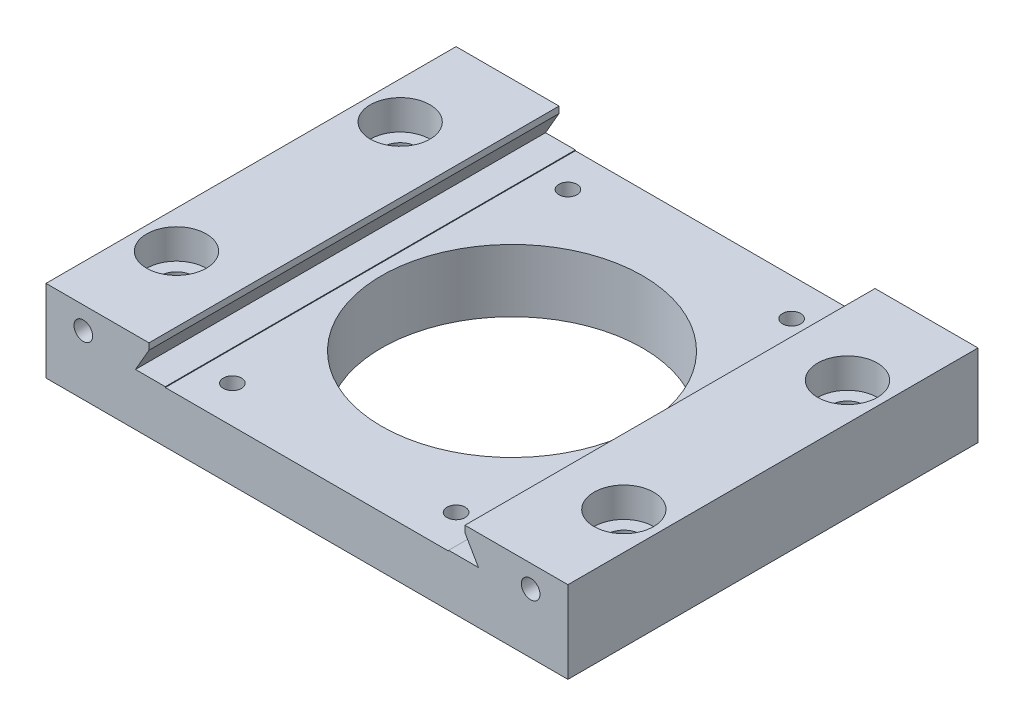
SolidWorks part; units mm, degrees
ref_plane "Front Plane" through (0, 0, 0) normal (0, 0, 1) x (1, 0, 0)
ref_plane "Top Plane" through (0, 0, 0) normal (0, 1, 0) x (1, 0, 0)
ref_plane "Right Plane" through (0, 0, 0) normal (1, 0, 0) x (0, 0, -1)
sketch "Sketch1" plane through (0, 0, 0) normal (1, 0, 0) x (0, 0, -1)
  line L0 (0, 0) -> (27.5, 0)
  line L1 (27.5, 0) -> (27.5, 11)
  line L2 (27.5, 11) -> (-27.5, 11)
  line L3 (-27.5, 11) -> (-27.5, 0)
  line L4 (-27.5, 0) -> (0, 0)
  dimension "D1" = 27.5
  dimension "D2" = 27.5
  dimension "D3" = 11
extrude "Boss-Extrude1" add sketch "Sketch1" along normal mid plane 70
sketch "Sketch2" plane through (0, 0, 27.5) normal (0, 0, 1) x (1, 0, 0)
  line L0 (-20.6906, 11) -> (-23, 7)
  line L2 (35, 11) -> (-35, 11) construction
  line L3 (-23, 7) -> (0, 7)
  line L5 (23, 7) -> (20.6906, 11)
  line L6 (20.6906, 11) -> (-20.6906, 11)
  line L8 (0, 7) -> (23, 7)
  line L9 (0, 0) -> (0, 7) construction
  dimension "D1" = 23
  dimension "D2" = 60
  dimension "D3" = 60
  dimension "D4" = 4
extrude "Cut-Extrude1" cut sketch "Sketch2" against normal through all
sketch "Sketch4" plane through (0, 7, 0) normal (0, 1, 0) x (1, 0, 0)
  line L0 (-23, 27.5) -> (23, 27.5) construction
  line L1 (-19, -27.5) -> (19, -27.5)
  line L2 (-19, -27.5) -> (-19, 27.5)
  line L3 (-19, 27.5) -> (19, 27.5)
  line L4 (19, -27.5) -> (19, 27.5)
  line L5 (-19, -27.5) -> (19, 27.5) construction
  line L6 (-19, 27.5) -> (19, -27.5) construction
  point P0 (0, 0)
  dimension "D1" = 38
extrude "Cut-Extrude3" cut sketch "Sketch4" against normal blind 0.1
sketch "Sketch5" plane through (0, 11, 0) normal (0, 1, 0) x (1, 0, 0)
  line L0 (-20.6906, 27.5) -> (-20.6906, -27.5) construction
  line L1 (-20.6906, -8) -> (-24, -8)
  line L2 (-20.6906, -8) -> (-20.6906, 8)
  line L3 (-20.6906, 8) -> (-24, 8)
  line L4 (-24, -8) -> (-24, 8)
  line L5 (20.6906, 27.5) -> (20.6906, -27.5) construction
  line L6 (20.6906, -8) -> (24, -8)
  line L7 (20.6906, -8) -> (20.6906, 8)
  line L8 (20.6906, 8) -> (24, 8)
  line L9 (24, -8) -> (24, 8)
  line L10 (35, -27.5) -> (20.6906, -27.5) construction
  dimension "D1" = 24
  dimension "D2" = 16
  dimension "D3" = 19.5
extrude "Cut-Extrude4" [suppressed] cut sketch "Sketch5" against normal up to surface (4 mm away)
sketch "Sketch11" plane through (0, 0, 0) normal (0, -1, 0) x (1, 0, 0)
  line L1 (-13, 22.5) -> (-26, 22.5) construction
  line L2 (-13, 19.5) -> (-26, 19.5)
  line L3 (-13, 25.5) -> (-26, 25.5)
  arc A0 (-13, 19.5) -> (-13, 25.5) centre (-13, 22.5) ccw
  arc A1 (-26, 25.5) -> (-26, 19.5) centre (-26, 22.5) ccw
  point P6 (-19.5, 22.5)
  dimension "D1" = 3
  dimension "D2" = 22.5
  dimension "D3" = 13
  dimension "D4" = 19.5
extrude "Cut-Extrude7" cut sketch "Sketch11" against normal blind 4.5
hole_wizard "M3x0.5 Tapped Hole1" positions "Sketch23" profile "Sketch22" tap size "M3x0.5" standard "ANSI Metric"
sketch "Sketch23" plane through (0, 4.5, 0) normal (0, -1, 0) x (-1, 0, 0)
  line L1 (25.5, -25.5) -> (25.5, -22.5) construction
  line L2 (13, -25.5) -> (26, -25.5) construction
  line L3 (25.5, -22.5) -> (25.5, -19.5) construction
  line L4 (26, -19.5) -> (13, -19.5) construction
  point P0 (25.5, -22.5)
  dimension "D1" = 25.5
sketch "Sketch22" plane through (-25.5, 4.5, 22.5) normal (1, 0, 0) x (0, 0, -1)
  line L0 (0, 0) -> (0, 5.2511)
  line L1 (0, 5.2511) -> (1.25, 4.5)
  line L2 (1.25, 4.5) -> (1.25, 0)
  line L5 (1.25, 0) -> (0, 0)
  line L10 (0, 5.2511) -> (-1.25, 4.5) construction
  line L11 (0, -6.35) -> (0, 107.95) construction
  dimension "Tap Drill Dia." = 2.5
  dimension "Tap Drill Depth" = 4.5
  dimension "Drill Angle" = 118
hole_wizard "Ø3.1 (3.1) Diameter Hole1" positions "Sketch34" profile "Sketch33" hole size "Ø3.1" standard "ANSI Metric"
sketch "Sketch34" plane through (0, 4.5, 0) normal (0, -1, 0) x (-1, 0, 0)
  line L0 (25.5, -22.5) -> (15, -22.5) construction
  point P0 (15, -22.5)
  dimension "D1" = 10.5
sketch "Sketch33" plane through (-15, 4.5, 22.5) normal (1, 0, 0) x (0, 0, -1)
  line L0 (0, 0) -> (0, 3.1313)
  line L1 (0, 3.1313) -> (1.55, 2.2)
  line L2 (1.55, 2.2) -> (1.55, 0)
  line L5 (1.55, 0) -> (0, 0)
  line L10 (0, 3.1313) -> (-1.55, 2.2) construction
  line L11 (0, -6.35) -> (0, 107.95) construction
  dimension "Hole Dia." = 3.1
  dimension "Hole Depth" = 2.2
  dimension "Drill Angle" = 118
mirror "Mirror1" about plane through (0, 0, 0) normal (0, 0, 1) of "Ø3.1 (3.1) Diameter Hole1", "Cut-Extrude7", "M3x0.5 Tapped Hole1"
mirror "Mirror2" about plane through (0, 0, 0) normal (1, 0, 0) of "Cut-Extrude7", "Mirror1", "M3x0.5 Tapped Hole1", "Ø3.1 (3.1) Diameter Hole1"
sketch "Sketch27" plane through (0, 0, 0) normal (0, -1, 0) x (1, 0, 0)
  circle A0 centre (0, 0) radius 19.5
  dimension "D1" = 39
extrude "Boss-Extrude2" add sketch "Sketch27" along normal blind 1.5
sketch "Sketch28" plane through (0, -1.5, 0) normal (0, -1, 0) x (1, 0, 0)
  circle A0 centre (0, 0) radius 17.5
  dimension "D1" = 35
extrude "Cut-Extrude8" cut sketch "Sketch28" against normal through all
hole_wizard "CBORE for M4 SHCS1" positions "Sketch30" profile "Sketch29" counterbore size "M4" standard "ANSI Metric"
sketch "Sketch30" plane through (0, 11, 0) normal (0, 1, 0) x (1, 0, 0)
  line L0 (-30, 15) -> (30, 15) construction
  line L1 (30, 15) -> (30, -15) construction
  line L2 (30, -15) -> (-30, -15) construction
  line L3 (-30, -15) -> (-30, 15) construction
  line L4 (-30, 15) -> (-35, 15) construction
  line L5 (-35, 27.5) -> (-35, -27.5) construction
  line L7 (30, 15) -> (35, 15) construction
  line L8 (35, 27.5) -> (35, -27.5) construction
  line L10 (30, 15) -> (30, 27.5) construction
  line L11 (35, 27.5) -> (20.6906, 27.5) construction
  line L13 (30, -15) -> (30, -27.5) construction
  line L14 (35, -27.5) -> (20.6906, -27.5) construction
  point P0 (-30, 15)
  point P2 (-30, -15)
  point P4 (30, 15)
  point P6 (30, -15)
  dimension "D1" = 30
  dimension "D2" = 60
sketch "Sketch29" plane through (-30, 11, -15) normal (1, 0, 0) x (0, 0, 1)
  line L0 (0, 0) -> (0, 12.5)
  line L1 (0, 12.5) -> (2.25, 12.5)
  line L3 (2.25, 12.5) -> (2.25, 4)
  line L4 (2.25, 4) -> (4, 4)
  line L5 (4, 4) -> (4, 0)
  line L7 (4, 0) -> (0, 0)
  line L11 (0, -6.35) -> (0, 107.95) construction
  dimension "Thru Hole Dia." = 4.5
  dimension "Thru Hole Depth" = 12.5
  dimension "C'Bore Dia." = 8
  dimension "C'Bore Depth" = 4
sketch "Sketch31" plane through (0, 0, 27.5) normal (0, 0, 1) x (1, 0, 0)
  line L0 (-20.6906, 11) -> (-21.1906, 11)
  line L1 (-20.6906, 11) -> (-35, 11) construction
  line L2 (-21.1906, 11) -> (-21.1906, 10.134)
  line L3 (-20.6906, 11) -> (-23, 7) construction
  line L4 (-21.1906, 10.134) -> (-20.6906, 11)
  dimension "D1" = 0.5
extrude "Cut-Extrude9" cut sketch "Sketch31" against normal through all
mirror "Mirror3" about plane through (0, 0, 0) normal (1, 0, 0) of "Cut-Extrude9"
fillet "Fillet1" [suppressed] radius 2
hole_wizard "M3x0.5 Tapped Hole2" positions "Sketch36" profile "Sketch35" tap size "M3x0.5" standard "ANSI Metric"
sketch "Sketch36" plane through (0, 0, 27.5) normal (0, 0, 1) x (1, 0, 0)
  line L0 (-30, 8) -> (30, 8) construction
  line L1 (30, 8) -> (35, 8) construction
  line L2 (35, 11) -> (35, 0) construction
  line L4 (-30, 8) -> (-35, 8) construction
  line L5 (-35, 11) -> (-35, 0) construction
  line L7 (35, 0) -> (-35, 0) construction
  point P0 (-30, 8)
  point P2 (30, 8)
  dimension "D1" = 8
  dimension "D2" = 5
sketch "Sketch35" plane through (-30, 8, 27.5) normal (1, 0, 0) x (0, -1, 0)
  line L0 (0, 0) -> (0, 8.2511)
  line L1 (0, 8.2511) -> (1.25, 7.5)
  line L2 (1.25, 7.5) -> (1.25, 0)
  line L5 (1.25, 0) -> (0, 0)
  line L10 (0, 8.2511) -> (-1.25, 7.5) construction
  line L11 (0, -6.35) -> (0, 107.95) construction
  dimension "Tap Drill Dia." = 2.5
  dimension "Tap Drill Depth" = 7.5
  dimension "Drill Angle" = 118
